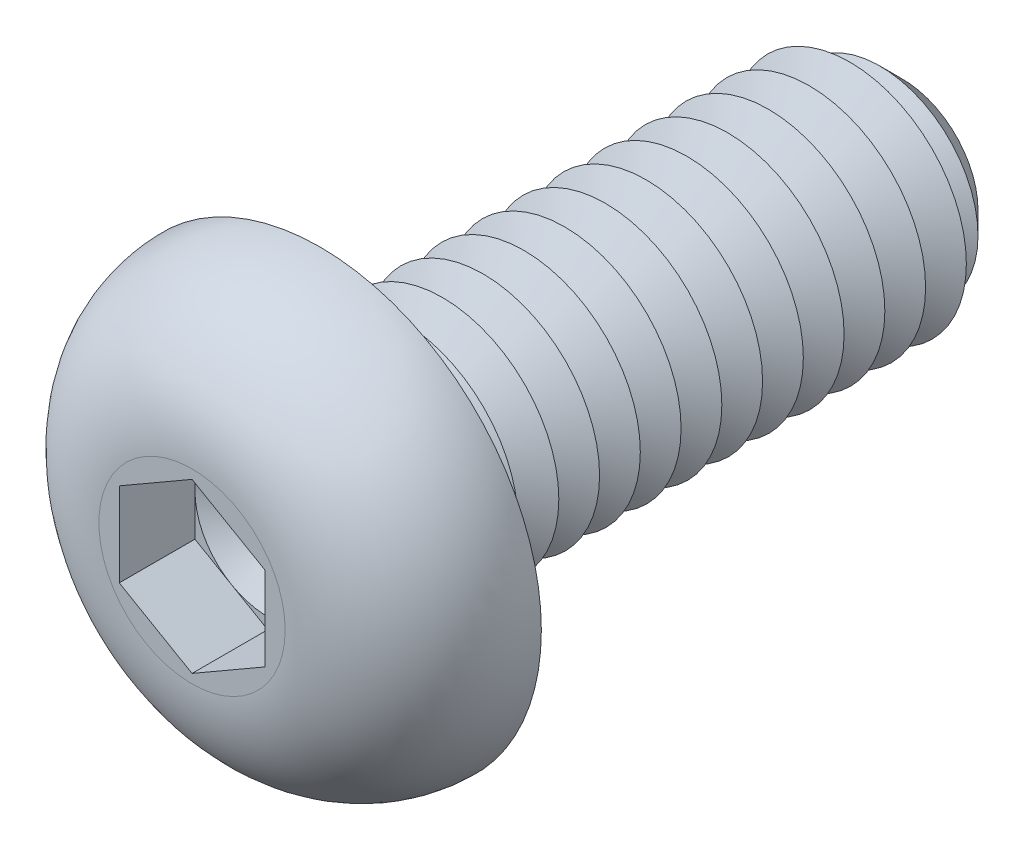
SolidWorks part; units mm, degrees
ref_plane "Front Plane" through (0, 0, 0) normal (0, 0, 1) x (1, 0, 0)
ref_plane "Top Plane" through (0, 0, 0) normal (0, 1, 0) x (1, 0, 0)
ref_plane "Right Plane" through (0, 0, 0) normal (1, 0, 0) x (0, 0, -1)
sketch "Sketch1" plane through (0, 0, 0) normal (1, 0, 0) x (0, 0, -1)
  line L0 (-47.9342, 0) -> (60.3146, 0) construction
sketch "Sketch2" plane through (0, 0, 0) normal (1, 0, 0) x (0, 0, -1)
  line L0 (0, 0) -> (-2.2, 0)
  line L1 (-47.9342, 0) -> (60.3146, 0) construction
  line L2 (-2.2, 0) -> (-2.2, 1.6)
  line L3 (0, 3.8) -> (0, 0)
  arc A0 (-2.2, 1.6) -> (0, 3.8) centre (0, 1.6) cw
  dimension "D1" = 2.2
  dimension "D2" = 2.2
  dimension "D3" = 3.8
revolve "Revolve1" add sketch "Sketch2" angle 360 about L0
sketch "Sketch3" plane through (0, 0, 2.2) normal (0, 0, 1) x (1, 0, 0)
  line L1 (0, 1.4434) -> (-1.25, 0.7217)
  line L2 (-1.25, 0.7217) -> (-1.25, -0.7217)
  line L3 (-1.25, -0.7217) -> (0, -1.4434)
  line L4 (0, -1.4434) -> (1.25, -0.7217)
  line L5 (1.25, -0.7217) -> (1.25, 0.7217)
  line L6 (1.25, 0.7217) -> (0, 1.4434)
  circle A0 centre (0, 0) radius 1.25 construction
  dimension "D1" = 2.5
extrude "Cut-Extrude1" cut sketch "Sketch3" against normal blind 1.3
sketch "Sketch4" plane through (0, 0, 0) normal (0, 0, -1) x (-1, 0, 0)
  circle A0 centre (0, 0) radius 2
  dimension "D1" = 4
extrude "Boss-Extrude1" add sketch "Sketch4" along normal blind 10
chamfer "Chamfer1" distance 0.7 angle 45 1 edges at (-2, 0, -10)
sketch "Sketch5" plane through (0, 0, 0) normal (1, 0, 0) x (0, 0, -1)
  line L0 (0.7, 2) -> (1.4, 2)
  line L1 (9.3, 2) -> (0, 2) construction
  line L2 (1.4, 2) -> (1.05, 1.3938)
  line L3 (1.05, 1.3938) -> (0.7, 2)
  line L4 (0, -3.8) -> (0, 3.8) construction
  line L5 (9.3, 2) -> (0, 2) construction
  dimension "D1" = 0.7
  dimension "D2" = 0.7
revolve "Cut-Revolve1" cut sketch "Sketch5" angle 360 about L0
pattern_linear "LPattern1" count 13 spacing 0.7 along (0, 0, -1) of "Cut-Revolve1"
fillet "Fillet2" radius 0.3 1 edges at (2, 0, 0)
sketch "Sketch6" plane through (0, 0, 0.9) normal (0, 0, 1) x (1, 0, 0)
  line L0 (0, -1.4434) -> (1.25, -0.7217) construction
  circle A0 centre (0, 0) radius 1.25
extrude "Cut-Extrude2" cut sketch "Sketch6" against normal through all draft 60
